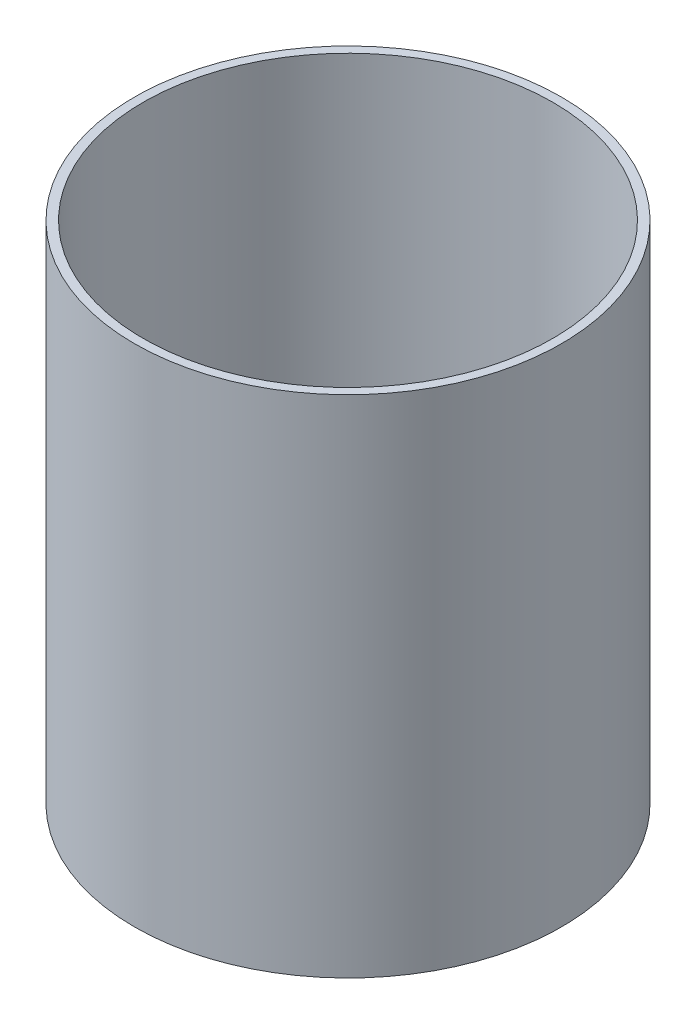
SolidWorks part; units mm, degrees
ref_plane "Plan de face" through (0, 0, 0) normal (0, 0, 1) x (1, 0, 0)
ref_plane "Plan de dessus" through (0, 0, 0) normal (0, 1, 0) x (1, 0, 0)
ref_plane "Plan de droite" through (0, 0, 0) normal (1, 0, 0) x (0, 0, -1)
sketch "Esquisse1" plane through (0, 0, 0) normal (0, 1, 0) x (1, 0, 0)
  circle A0 centre (0, 0) radius 23.1
  circle A1 centre (0, 0) radius 24.1
  dimension "D1" = 1
  dimension "D2" = 48.2
extrude "Extrusion1" add sketch "Esquisse1" along normal blind 57
